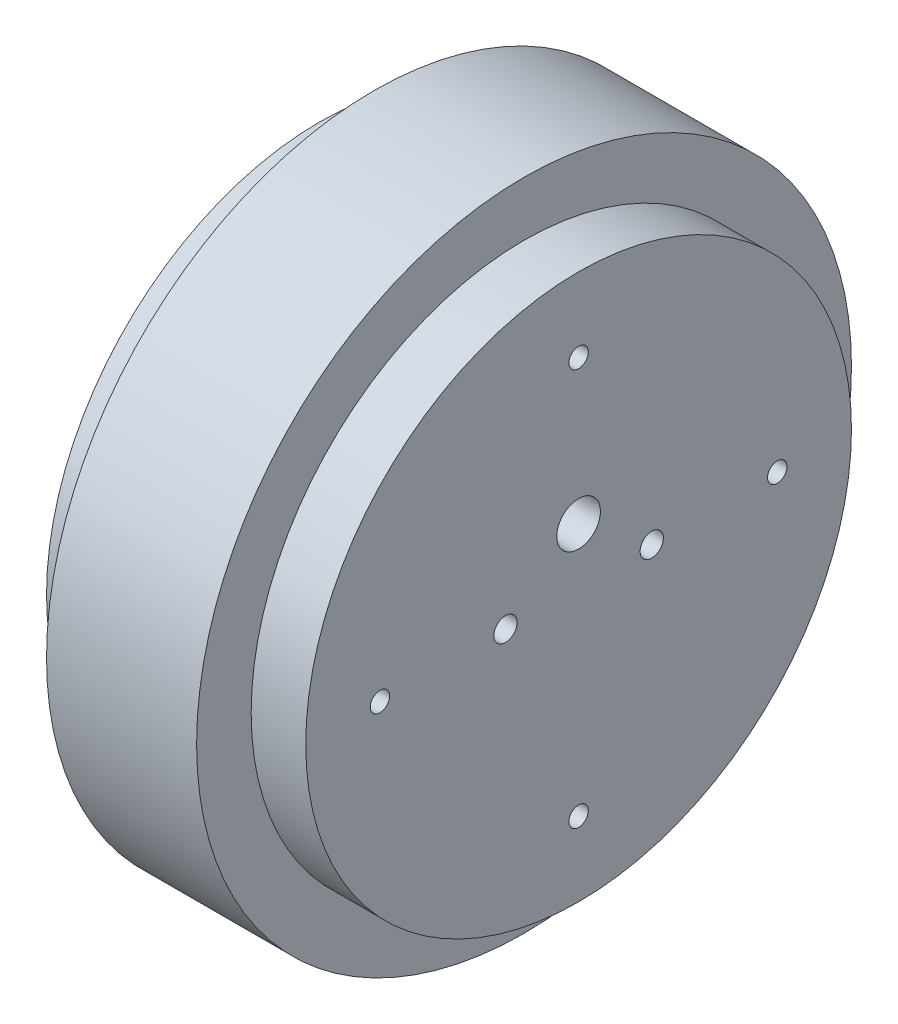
SolidWorks part; units mm, degrees
ref_plane "Front" through (0, 0, 0) normal (0, 0, 1) x (1, 0, 0)
ref_plane "Top" through (0, 0, 0) normal (0, 1, 0) x (1, 0, 0)
ref_plane "Right" through (0, 0, 0) normal (1, 0, 0) x (0, 0, -1)
sketch "Sketch1" plane through (0, 0, 0) normal (0, 0, 1) x (1, 0, 0)
  line L0 (-23.8125, 38.1) -> (-23.8125, 31.75)
  line L1 (-23.8125, 31.75) -> (-30.1625, 31.75)
  line L2 (-30.1625, 31.75) -> (-30.1625, 28.8925)
  line L3 (-30.1625, 28.8925) -> (-11.1125, 28.8925)
  line L4 (-11.1125, 28.8925) -> (-11.1125, 22.86)
  line L5 (-4.7625, 0) -> (0, 0)
  line L6 (0, 0) -> (0, 31.75)
  line L7 (0, 31.75) -> (-6.35, 31.75)
  line L8 (-6.35, 31.75) -> (-6.35, 38.1)
  line L9 (-6.35, 38.1) -> (-23.8125, 38.1)
  line L10 (-11.1125, 22.86) -> (-4.7625, 22.86)
  line L11 (-4.7625, 22.86) -> (-4.7625, 0)
  line L12 (-11.1125, 25.4) -> (-9.7917, 25.4)
  line L13 (-9.7917, 25.4) -> (-9.7917, 27.5336)
  line L14 (-9.7917, 27.5336) -> (-11.1125, 27.5336)
  dimension "D1" = 28.8925
  dimension "D2" = 19.05
  dimension "D3" = 6.35
  dimension "D4" = 4.7625
  dimension "D5" = 31.75
  dimension "D6" = 6.35
  dimension "D7" = 31.75
  dimension "D8" = 38.1
  dimension "D9" = 22.86
  dimension "D10" = 6.35
  dimension "D11" = 1.3208
  dimension "D12" = 2.1336
  dimension "D13" = 25.4
revolve "Revolve1" add sketch "Sketch1" angle 360 about L5
sketch "Sketch2" plane through (-4.7625, 0, 0) normal (-1, 0, 0) x (0, 0, 1)
  line L0 (-8.509, 0) -> (8.509, 0) construction
  line L1 (0, 6.35) -> (0, 0) construction
  circle A2 centre (0, 6.35) radius 2.54
  dimension "D4" = 5.08
  dimension "D2" = 17.018
  dimension "D3" = 6.35
extrude "Cut-Extrude1" cut sketch "Sketch2" against normal up to next
hole_wizard "#4-40 Tapped Hole1" positions "Sketch4" profile "Sketch3" tap size "#4-40" standard "ANSI Inch"
sketch "Sketch4" plane through (0, 0, 0) normal (1, 0, 0) x (0, 0, -1)
  circle A0 centre (0, 0) radius 23.114
  point P6 (0, 23.114)
  point P8 (23.114, 0)
  point P10 (0, -23.114)
  point P12 (-23.114, 0)
  dimension "D1" = 46.228
sketch "Sketch3" plane through (0, 23.114, 0) normal (0, 1, 0) x (0, 0, -1)
  line L0 (0, 0) -> (0, 4.318)
  line L1 (0, 4.318) -> (1.1303, 4.318)
  line L2 (1.1303, 4.318) -> (1.1303, 0)
  line L5 (1.1303, 0) -> (0, 0)
  line L10 (0, 4.318) -> (-1.1303, 4.318) construction
  line L11 (0, -6.35) -> (0, 107.95) construction
  dimension "Tap Drill Dia." = 2.2606
  dimension "Tap Drill Depth" = 4.318
  dimension "Drill Angle" = 180
hole_wizard "#6-32 Tapped Hole1" positions "Sketch6" profile "Sketch5" tap size "#6-32" standard "ANSI Inch"
sketch "Sketch6" plane through (-4.7625, 0, 0) normal (-1, 0, 0) x (0, 0, 1)
  line L0 (-8.509, 0) -> (0, 0) construction
  line L1 (0, 0) -> (8.509, 0) construction
  point P0 (-8.509, 0)
  point P2 (8.509, 0)
  dimension "D1" = 17.018
sketch "Sketch5" plane through (-4.7625, 0, -8.509) normal (0, 1, 0) x (0, 0, 1)
  line L0 (0, 0) -> (0, 4.7625)
  line L1 (0, 4.7625) -> (1.3525, 4.7625)
  line L2 (1.3525, 4.7625) -> (1.3525, 0)
  line L5 (1.3525, 0) -> (0, 0)
  line L11 (0, -6.35) -> (0, 107.95) construction
  dimension "Thread Major Dia." = 2.7051
  dimension "Thru Tap Drill Depth" = 4.7625
